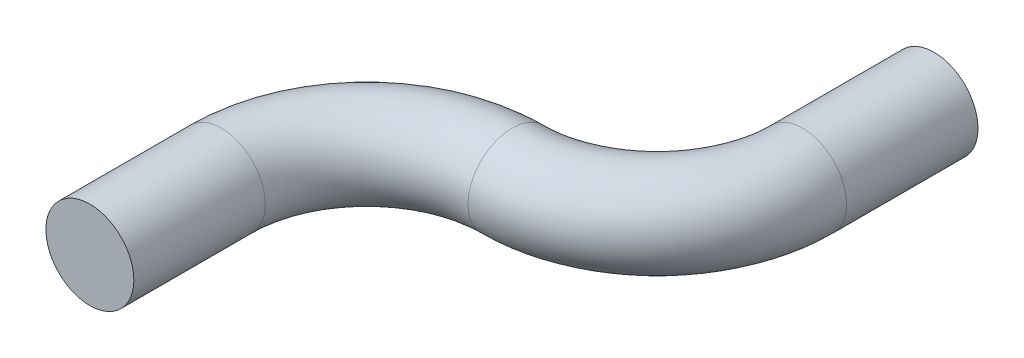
SolidWorks part; units mm, degrees
ref_plane "Front Plane" through (0, 0, 0) normal (0, 0, 1) x (1, 0, 0)
ref_plane "Top Plane" through (0, 0, 0) normal (0, 1, 0) x (1, 0, 0)
ref_plane "Right Plane" through (0, 0, 0) normal (1, 0, 0) x (0, 0, -1)
sketch "Sketch1" plane through (0, 0, 0) normal (0, 1, 0) x (1, 0, 0)
  line L0 (0, 0) -> (0, 45.4577)
  line L1 (100.4854, 145.943) -> (100.4854, 191.4007)
  arc A0 (0, 45.4577) -> (50.2427, 95.7004) centre (50.2427, 45.4577) cw
  arc A1 (50.2427, 95.7004) -> (100.4854, 145.943) centre (50.2427, 145.943) ccw
sketch "Sketch2" plane through (0, 0, 0) normal (0, 0, 1) x (1, 0, 0)
  circle A0 centre (0, 0) radius 15.2028
sweep "Sweep1" add profiles "Sketch2" path "Sketch1"
